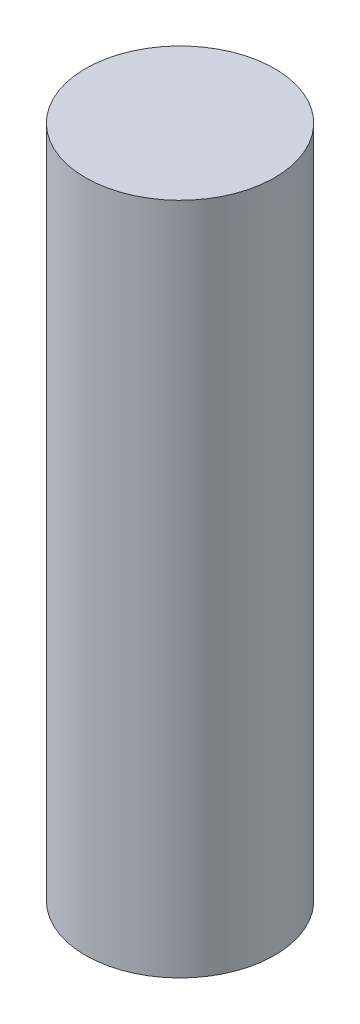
SolidWorks part; units mm, degrees
ref_plane "Front" through (0, 0, 0) normal (0, 0, 1) x (1, 0, 0)
ref_plane "Top" through (0, 0, 0) normal (0, 1, 0) x (1, 0, 0)
ref_plane "Right" through (0, 0, 0) normal (1, 0, 0) x (0, 0, -1)
sketch "Sketch1" plane through (0, 0, 0) normal (0, 1, 0) x (1, 0, 0)
  circle A0 centre (0, 0) radius 9.125
  dimension "D1" = 18.25
extrude "Boss-Extrude1" add sketch "Sketch1" along normal blind 65
